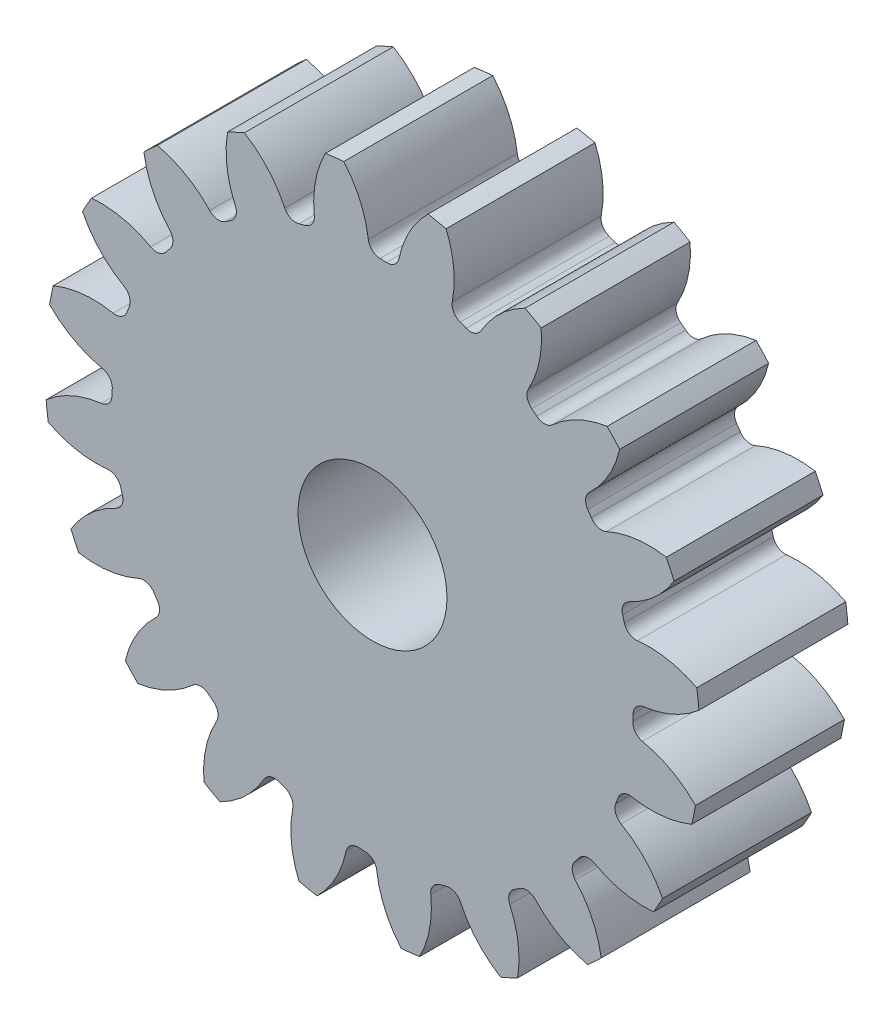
SolidWorks part; units mm, degrees
ref_plane "Front" through (0, 0, 0) normal (0, 0, 1) x (1, 0, 0)
ref_plane "Top" through (0, 0, 0) normal (0, 1, 0) x (1, 0, 0)
ref_plane "Right" through (0, 0, 0) normal (1, 0, 0) x (0, 0, -1)
sketch "Sketch3" plane through (0, 0, 0) normal (0, 0, 1) x (1, 0, 0)
  circle A0 centre (0, 0) radius 223.52
  dimension "od" = 447.04
extrude "gearBody" add sketch "Sketch3" along normal blind 101.6
sketch "Sketch2" plane through (0, 0, 0) normal (0, 0, 1) x (1, 0, 0)
  line L0 (0, 0) -> (176.4107, 73.0717) construction
  line L1 (221.0972, -38.6128) -> (0, 0) construction
  line L2 (0, 0) -> (36.3143, 0) construction
  line L3 (203.0587, 7.5755) -> (201.7524, -24.212) construction
  line L5 (202.4056, -8.3182) -> (0, 0) construction
  line L7 (0, 0) -> (190.9455, 0) construction
  arc A0 (190.9064, 3.8637) -> (189.9456, -19.5155) centre (0, 0) ccw construction
  arc A1 (222.6603, 19.5849) -> (220.3024, -37.7893) centre (0, 0) ccw construction
  arc A2 (203.0587, 7.5755) -> (201.7524, -24.212) centre (0, 0) ccw construction
  arc A3 (177.5454, -9.5125) -> (177.7272, -5.0881) centre (0, 0) ccw
  arc A4 (221.0972, -38.6128) -> (184.13, -18.0541) centre (169.8199, -87.3007) ccw
  arc A5 (221.0972, -38.6128) -> (223.52, 20.3405) centre (0, 0) ccw
  arc A6 (223.52, 20.3405) -> (184.9905, 2.8844) centre (176.4107, 73.0717) cw
  arc A7 (177.7272, -5.0881) -> (184.9905, 2.8844) centre (185.994, -5.3247) cw
  arc A8 (184.13, -18.0541) -> (177.5454, -9.5125) centre (185.8037, -9.955) cw
  point P6 (223.52, 20.3405)
  point P22 (221.0972, -38.6128)
  dimension "baseDia" = 381.8911
  dimension "od" = 447.04
  dimension "pd" = 406.4
  dimension "rd" = 355.6
  dimension "rFillet" = 8.2702
  dimension "pointX" = 223.52
  dimension "pointY" = 20.3405
  dimension "CTT" = 31.7875
  dimension "flankCenterAngle" = 22.5
extrude "toothCut" cut sketch "Sketch2" along normal through all
pattern_circular "CirPattern1" count 20 over 360 about axis through (0, 0, 0) along (0, 0, 1) of "toothCut"
sketch "hub1Dia" plane through (0, 0, 0) normal (0, 0, -1) x (-1, 0, 0)
  circle A0 centre (0, 0) radius 12.7
  dimension "hub1Dia" = 25.4
sketch "hub2Dia" plane through (0, 0, 101.6) normal (0, 0, 1) x (1, 0, 0)
  circle A0 centre (0, 0) radius 12.7
  dimension "hub2dia" = 25.4
sketch "boreDia" plane through (0, 0, 0) normal (0, 0, 1) x (1, 0, 0)
  circle A0 centre (0, 0) radius 50.8
  dimension "boreDia" = 101.6
extrude "bore" cut sketch "boreDia" against normal mid plane 25400
